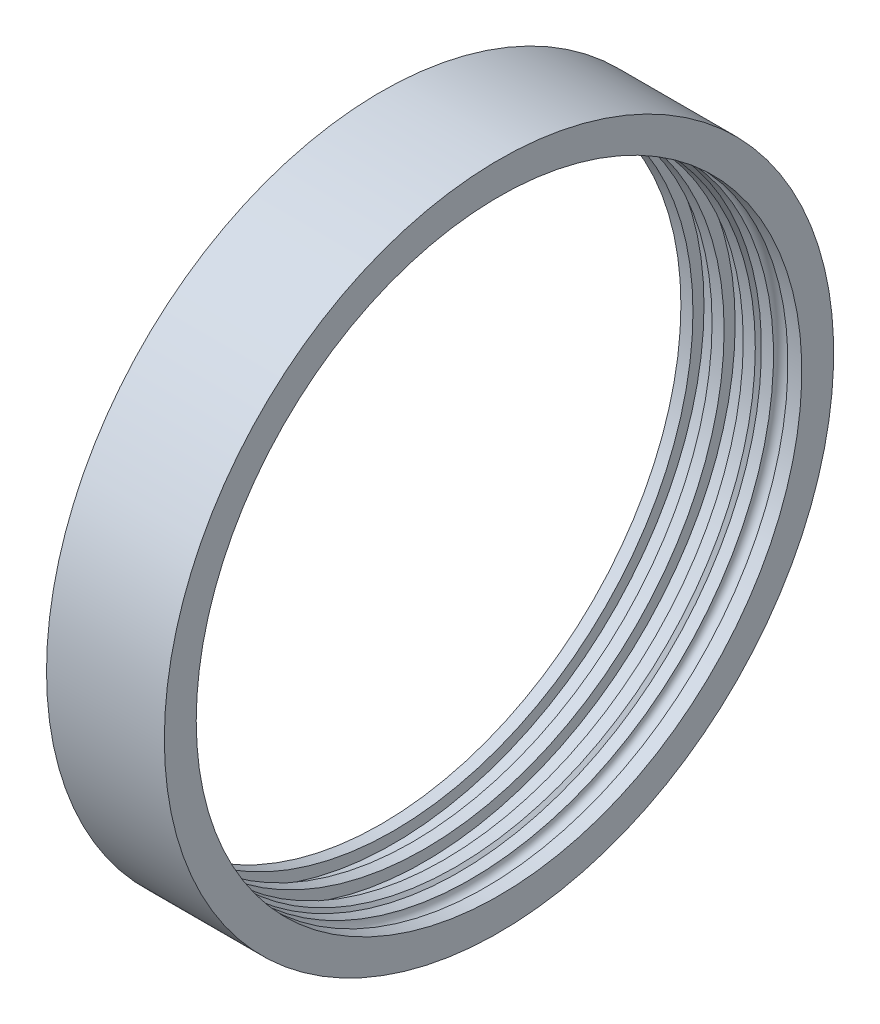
SolidWorks part; units mm, degrees
ref_plane "Front Plane" through (0, 0, 0) normal (0, 0, 1) x (1, 0, 0)
ref_plane "Top Plane" through (0, 0, 0) normal (0, 1, 0) x (1, 0, 0)
ref_plane "Right Plane" through (0, 0, 0) normal (1, 0, 0) x (0, 0, -1)
sketch "Sketch1" plane through (0, 0, 0) normal (0, 1, 0) x (1, 0, 0)
  line L0 (0, 0) -> (0, 83.185)
  line L1 (0, 83.185) -> (29.2862, 83.185)
  line L2 (29.2862, 83.185) -> (29.2862, 75.2602)
  line L3 (29.2862, 83.185) -> (29.2862, -83.185) construction
  line L4 (0, 0) -> (3.8479, 0)
  line L5 (29.2862, 75.2602) -> (25.8318, 75.2602) construction
  line L6 (29.2862, 75.2602) -> (25.8318, 75.2602)
  line L7 (29.2862, 75.2602) -> (25.8318, 75.2602) construction
  line L8 (19.2532, 75.2602) -> (22.2504, 75.2602)
  line L9 (19.2532, 75.2602) -> (19.2532, -75.2602) construction
  line L10 (19.2532, 75.2602) -> (18.4912, 74.4982) construction
  line L11 (19.2532, 75.2602) -> (18.4912, 74.4982)
  line L12 (18.4912, 74.4982) -> (15.494, 74.4982) construction
  line L13 (18.4912, 74.4982) -> (18.4912, -74.4982) construction
  line L14 (18.4912, 74.4982) -> (15.494, 74.4982)
  line L15 (15.494, 74.4982) -> (15.494, -74.4982) construction
  line L16 (18.4912, 74.4982) -> (15.494, 74.4982) construction
  line L17 (15.494, 74.4982) -> (15.494, 71.755)
  line L18 (15.494, 71.755) -> (15.494, -71.755) construction
  line L19 (15.494, 71.755) -> (10.7442, 71.755)
  line L20 (15.494, 71.755) -> (10.7442, 71.755) construction
  line L21 (10.7442, -74.4982) -> (10.7442, 74.4982) construction
  line L22 (10.7442, 71.755) -> (10.7442, 74.4982)
  line L23 (10.7442, 74.4982) -> (7.747, 74.4982)
  line L24 (7.747, 74.4982) -> (7.747, -74.4982) construction
  line L25 (7.747, 74.4982) -> (7.747, 71.755)
  line L26 (7.747, 71.755) -> (2.9972, 71.755) construction
  line L27 (7.747, 71.755) -> (2.9972, 71.755)
  line L28 (7.747, 71.755) -> (2.9972, 71.755) construction
  line L29 (2.9972, -74.4982) -> (2.9972, 74.4982) construction
  line L30 (2.9972, 71.755) -> (2.9972, 74.4982)
  line L31 (2.9972, 74.4982) -> (0, 74.4982)
  line L32 (22.2504, 75.2602) -> (19.2532, 75.2602) construction
  line L33 (22.2504, 75.2602) -> (25.8318, 75.2602)
  line L34 (15.494, 74.4982) -> (15.494, 77.2414)
  line L35 (15.494, 77.2414) -> (10.7442, 77.2414)
  line L36 (10.7442, 77.2414) -> (10.7442, 74.4982)
  line L37 (7.747, 74.4982) -> (7.747, 77.2414)
  line L38 (7.747, 77.2414) -> (2.9972, 77.2414)
  line L39 (2.9972, 77.2414) -> (2.9972, 74.4982)
  arc A0 (22.2504, 75.2602) -> (25.8318, 75.2602) centre (24.0411, 75.2602) ccw construction
  arc A1 (22.2504, 75.2602) -> (25.8318, 75.2602) centre (24.0411, 75.2602) ccw construction
  circle A2 centre (24.0411, 75.2602) radius 1.7907
  dimension "D1" = 3.5814
  dimension "D2" = 2.7432
  dimension "D3" = 2.7432
  dimension "D4" = 2.7432
  dimension "D5" = 2.7432
revolve "Revolve1" add sketch "Sketch1" angle 360 about L4
sketch "Sketch2" plane through (0, 0, 0) normal (-1, 0, 0) x (0, 0, 1)
  line L0 (0, 0) -> (0, 83.185)
  circle A0 centre (0, 0) radius 83.185 construction
ref_plane "Plane1" through (0, 0, 0) normal (0, 0, 1) x (0, 1, 0)
